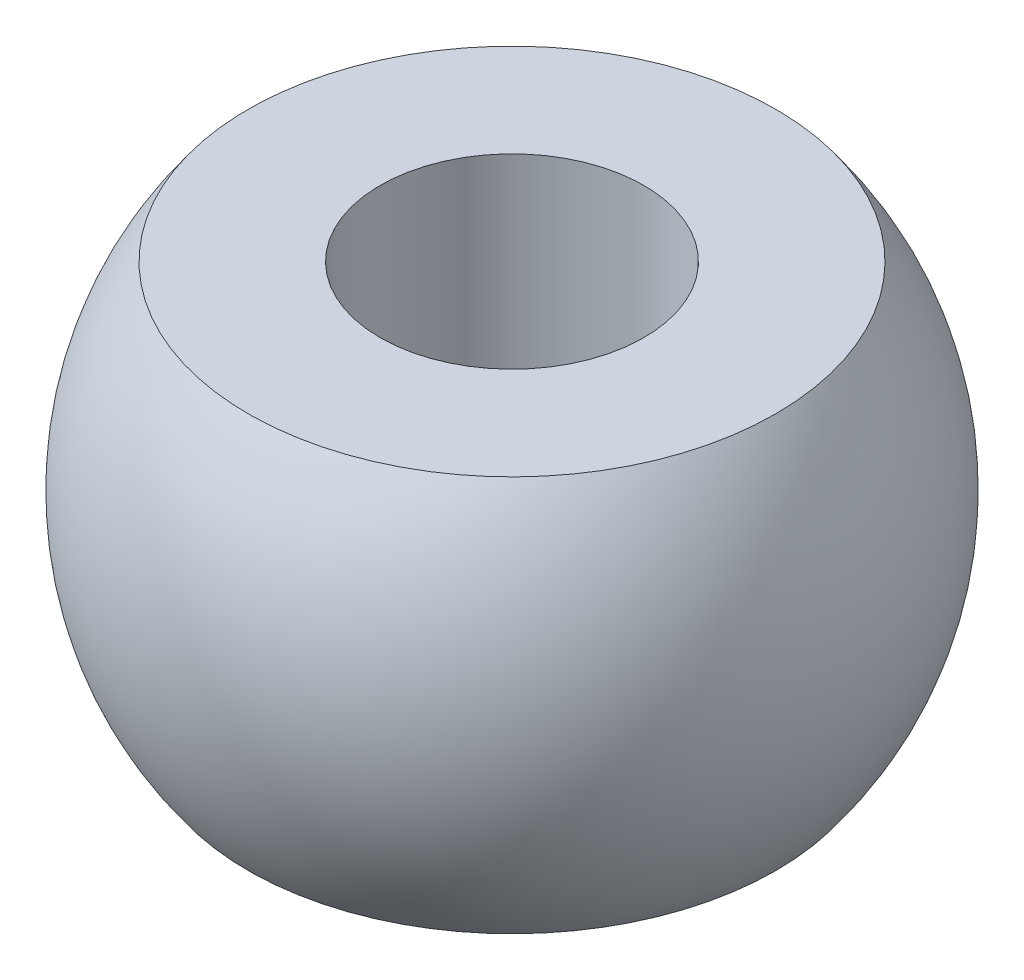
SolidWorks part; units mm, degrees
ref_plane "Face" through (0, 0, 0) normal (0, 0, 1) x (1, 0, 0)
ref_plane "Dessus" through (0, 0, 0) normal (0, 1, 0) x (1, 0, 0)
ref_plane "Droite" through (0, 0, 0) normal (1, 0, 0) x (0, 0, -1)
sketch "Esquisse1" plane through (0, 0, 0) normal (0, 0, 1) x (1, 0, 0)
  line L0 (0, 43.467) -> (0, -45.3478) construction
  line L1 (4, 6) -> (8, 6)
  line L2 (4, -6) -> (8, -6)
  line L3 (4, 6) -> (4, -6)
  arc A0 (8, -6) -> (8, 6) centre (0, 0) ccw
  dimension "D1" = 20
  dimension "D2" = 12
  dimension "D3" = 6
  dimension "D4" = 8
revolve "Révolution1" add sketch "Esquisse1" angle 360 about L0
